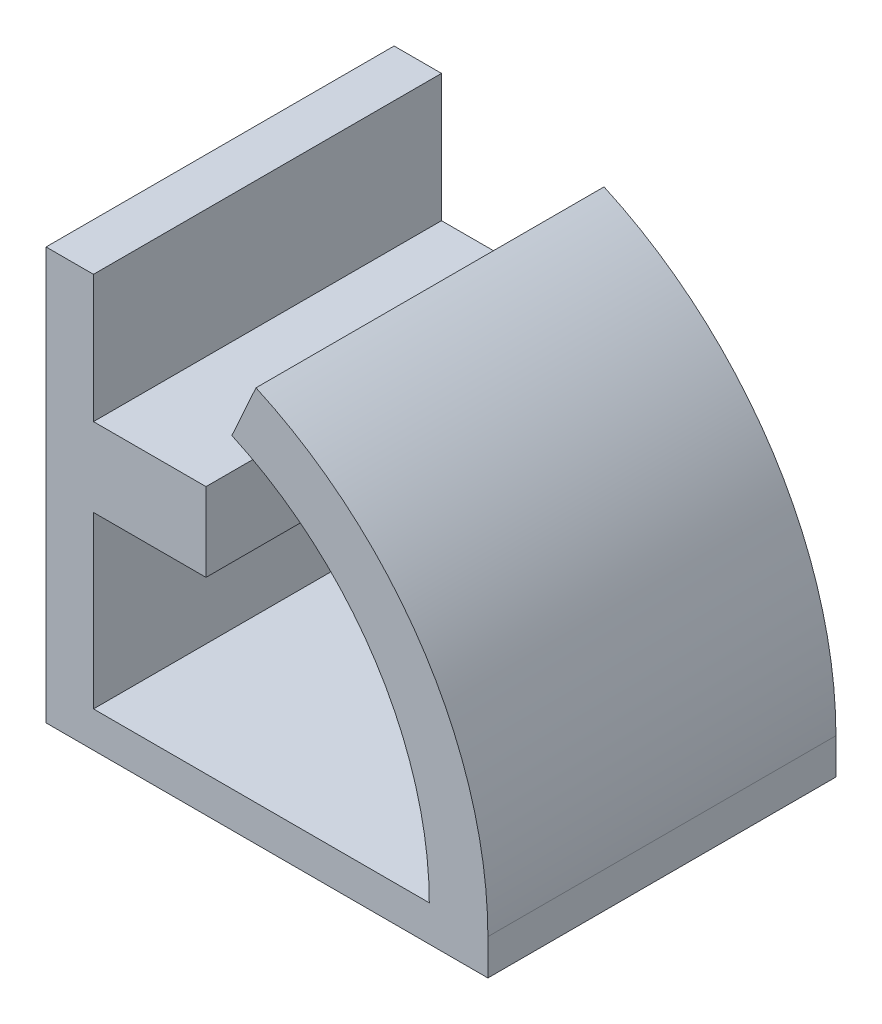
SolidWorks part; units mm, degrees
ref_plane "Front Plane" through (0, 0, 0) normal (0, 0, 1) x (1, 0, 0)
ref_plane "Top Plane" through (0, 0, 0) normal (0, 1, 0) x (1, 0, 0)
ref_plane "Right Plane" through (0, 0, 0) normal (1, 0, 0) x (0, 0, -1)
sketch "Sketch1" plane through (0, 0, 0) normal (0, 0, 1) x (1, 0, 0)
  line L0 (0, 157.5143) -> (0, 0)
  line L1 (0, 0) -> (168.8397, 0)
  line L2 (168.8397, 0) -> (168.8397, 13.6845)
  line L3 (168.8397, 13.6845) -> (18.1175, 13.6845)
  line L4 (18.1175, 13.6845) -> (18.1175, 157.5143)
  line L5 (18.1175, 157.5143) -> (0, 157.5143)
extrude "Boss-Extrude1" add sketch "Sketch1" along normal mid plane 133
sketch "Sketch3" plane through (18.1175, 0, 0) normal (1, 0, 0) x (0, 0, -1)
  line L0 (-66.5, 13.6845) -> (-66.5, 157.5143) construction
  line L1 (-66.5, 108.7619) -> (66.5, 108.7619)
  line L2 (-66.5, 108.7619) -> (-66.5, 78.7189)
  line L3 (-66.5, 78.7189) -> (66.5, 78.7189)
  line L4 (66.5, 108.7619) -> (66.5, 78.7189)
  line L5 (66.5, 13.6845) -> (66.5, 157.5143) construction
extrude "Boss-Extrude2" add sketch "Sketch3" along normal blind 43
sketch "Sketch2" plane through (0, 13.6845, 0) normal (0, 1, 0) x (-1, 0, 0)
  line L6 (-146.4482, 77.0597) -> (-146.4482, -76.6792)
revolve "Revolve2" add sketch "Sketch2" about axis through (18.1175, 13.6845, 66.5) along (0, 0, -1)
